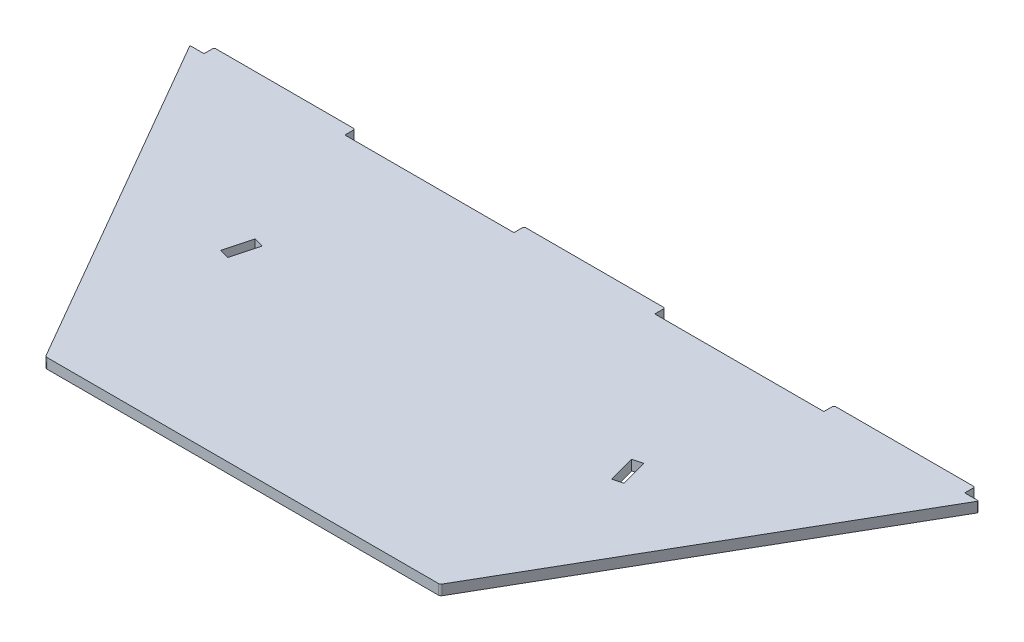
SolidWorks part; units mm, degrees
ref_plane "Alzado" through (0, 0, 0) normal (0, 0, 1) x (1, 0, 0)
ref_plane "Planta" through (0, 0, 0) normal (0, 1, 0) x (1, 0, 0)
ref_plane "Vista lateral" through (0, 0, 0) normal (1, 0, 0) x (0, 0, -1)
sketch "Croquis1" plane through (0, 0, 0) normal (0, 1, 0) x (1, 0, 0)
  line L0 (0, 0) -> (0, 606.2178) construction
  line L1 (350, 606.2178) -> (-350, 606.2178)
  line L2 (-350, 606.2178) -> (-700, 0)
  line L3 (-700, 0) -> (-350, -606.2178)
  line L4 (-350, -606.2178) -> (350, -606.2178)
  line L5 (350, -606.2178) -> (700, 0)
  line L6 (700, 0) -> (350, 606.2178)
  circle A0 centre (0, 0) radius 606.2178 construction
  dimension "D1" = 1400
extrude "Saliente-Extruir1" add sketch "Croquis1" along normal blind 18
sketch "Croquis2" plane through (0, 18, 0) normal (0, 1, 0) x (1, 0, 0)
  line L0 (700, 0) -> (350, 606.2178) construction
  line L1 (-700, 0) -> (700, 0)
  line L2 (-700, 0) -> (-700, 606.2178)
  line L3 (-700, 606.2178) -> (700, 606.2178)
  line L4 (700, 0) -> (700, 606.2178)
  line L6 (350, 606.2178) -> (-350, 606.2178) construction
extrude "Cortar-Extruir1" cut sketch "Croquis2" against normal through all
sketch "Croquis3" plane through (0, 18, 0) normal (0, 1, 0) x (1, 0, 0)
  line L0 (-700, 0) -> (700, 0) construction
  line L1 (-675, 0) -> (-425, 0)
  line L2 (-675, 0) -> (-675, 18)
  line L3 (-675, 18) -> (-425, 18)
  line L4 (-425, 0) -> (-425, 18)
  line L5 (0, 18) -> (0, 0) construction
  line L6 (-125, 0) -> (125, 0)
  line L7 (-125, 0) -> (-125, 18)
  line L8 (-125, 18) -> (125, 18)
  line L9 (125, 0) -> (125, 18)
  line L10 (425, 0) -> (675, 0)
  line L11 (425, 0) -> (425, 18)
  line L12 (425, 18) -> (675, 18)
  line L13 (675, 0) -> (675, 18)
  dimension "D1" = 18
  dimension "D2" = 250
  dimension "D3" = 250
  dimension "D4" = 250
  dimension "D5" = 300
  dimension "D6" = 300
extrude "Saliente-Extruir2" add sketch "Croquis3" against normal through all
sketch "Croquis4" plane through (0, 0, 0) normal (0, -1, 0) x (1, 0, 0)
  line L5 (345.1091, 239.1707) -> (327.7224, 243.8294)
  line L6 (0, 606.2178) -> (0, 0) construction
  line L7 (-350, 606.2178) -> (350, 606.2178) construction
  line L8 (327.7224, 243.8294) -> (340.6634, 292.1257)
  line L14 (340.6634, 292.1257) -> (358.0501, 287.467)
  line L15 (358.0501, 287.467) -> (345.1091, 239.1707)
  line L16 (-358.0501, 287.467) -> (-345.1091, 239.1707)
  line L17 (-340.6634, 292.1257) -> (-358.0501, 287.467)
  line L18 (-327.7224, 243.8294) -> (-340.6634, 292.1257)
  line L19 (-345.1091, 239.1707) -> (-327.7224, 243.8294)
extrude "Cortar-Extruir2" cut sketch "Croquis4" against normal through all
fillet "Redondeo1" radius 5 2 edges at (350, 9, 606.2178) (-350, 9, 606.2178)
chamfer "Chaflán1" distance 2 angle 45 8 edges at (-700, 9, 0) (700, 9, 0) (675, 9, -18) (425, 9, -18) (-125, 9, -18) (125, 9, -18) (-425, 9, -18) (-675, 9, -18)
